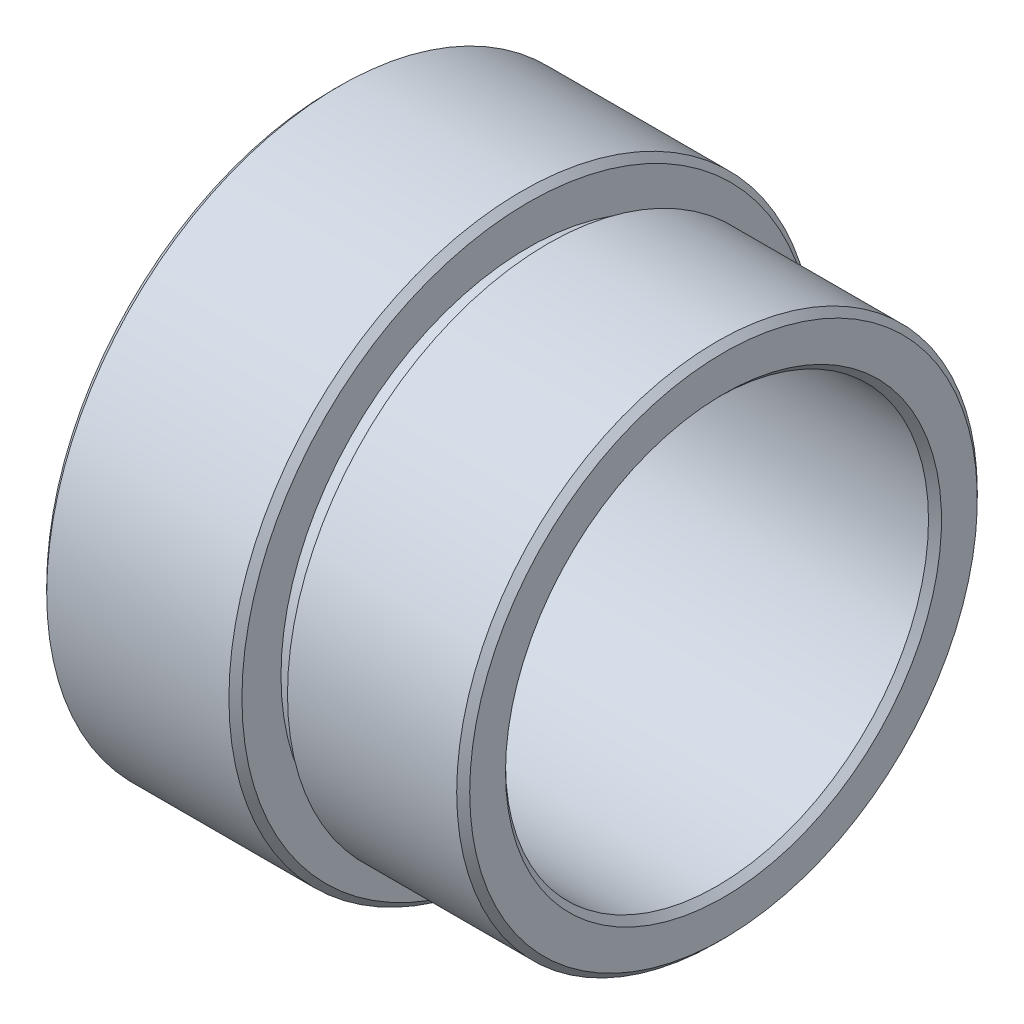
SolidWorks part; units mm, degrees
ref_plane "Plan de face" through (0, 0, 0) normal (0, 0, 1) x (1, 0, 0)
ref_plane "Plan de dessus" through (0, 0, 0) normal (0, 1, 0) x (1, 0, 0)
ref_plane "Plan de droite" through (0, 0, 0) normal (1, 0, 0) x (0, 0, -1)
sketch "Esquisse1" plane through (0, 0, 0) normal (0, 0, 1) x (1, 0, 0)
  line L0 (0, 0) -> (83.7447, 0) construction
  line L1 (11.9261, 45) -> (11.9261, 32.5)
  line L2 (11.9261, 32.5) -> (71.9261, 32.5)
  line L3 (71.9261, 32.5) -> (71.9261, 40)
  line L4 (71.9261, 40) -> (41.9261, 40)
  line L5 (41.9261, 40) -> (41.9261, 45)
  line L6 (41.9261, 45) -> (11.9261, 45)
  dimension "D1" = 30
  dimension "D2" = 30
  dimension "D3" = 32.5
  dimension "D4" = 45
  dimension "D5" = 40
revolve "Révolution1" add sketch "Esquisse1" angle 360 about L0
chamfer "Chanfrein1" distance 1 angle 45 5 edges at (11.9261, 0, 32.5) (71.9261, 0, 32.5) (11.9261, 0, 45) (41.9261, 0, 45) (71.9261, 0, 40)
sketch "Esquisse2" plane through (41.9261, 0, 0) normal (1, 0, 0) x (0, 0, -1)
  circle A0 centre (0, 0) radius 38
  circle A1 centre (0, 0) radius 45 construction
  dimension "D1" = 76
extrude "Enlèv. mat.-Extru.1" cut sketch "Esquisse2" along normal blind 3 flip side to cut
